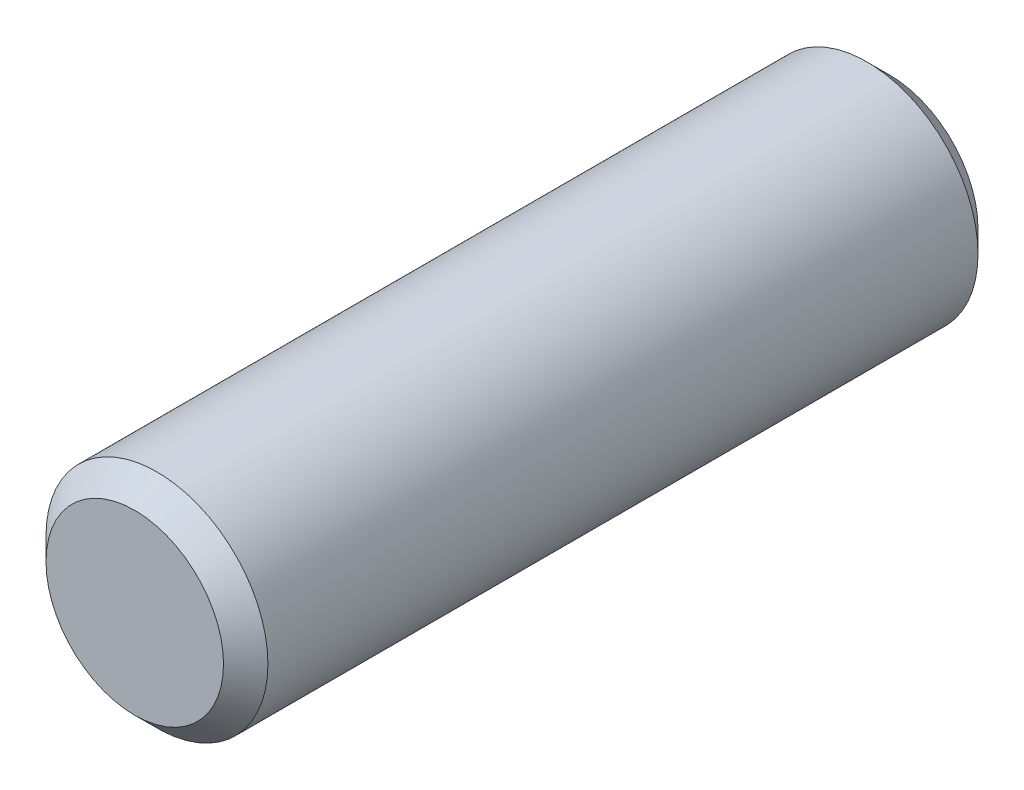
SolidWorks part; units mm, degrees
ref_plane "Face" through (0, 0, 0) normal (0, 0, 1) x (1, 0, 0)
ref_plane "Dessus" through (0, 0, 0) normal (0, 1, 0) x (1, 0, 0)
ref_plane "Droite" through (0, 0, 0) normal (1, 0, 0) x (0, 0, -1)
sketch "Esquisse1" plane through (0, 0, 0) normal (0, 0, 1) x (1, 0, 0)
  circle A0 centre (0, 0) radius 2.5
  dimension "D1" = 5
extrude "Base-Extrusion" add sketch "Esquisse1" along normal mid plane 17
chamfer "Chanfrein1" distance 0.5 angle 45
